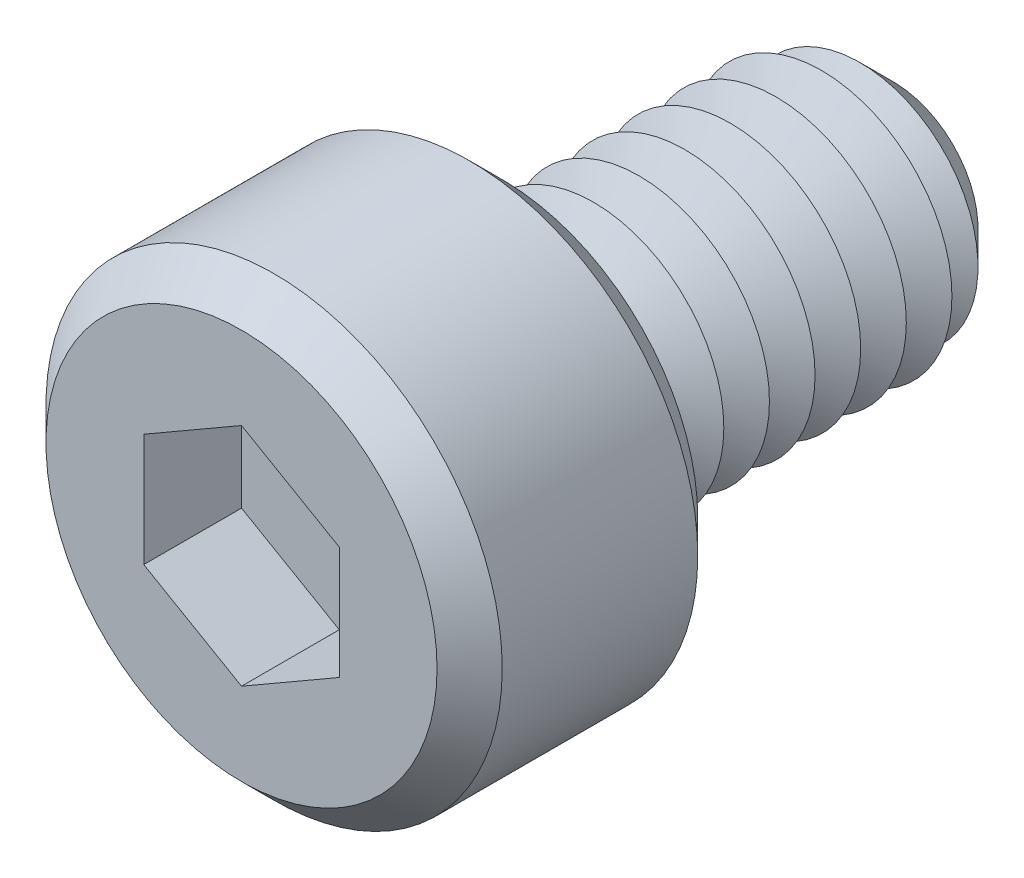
SolidWorks part; units mm, degrees
ref_plane "Front Plane" through (0, 0, 0) normal (0, 0, 1) x (1, 0, 0)
ref_plane "Top Plane" through (0, 0, 0) normal (0, 1, 0) x (1, 0, 0)
ref_plane "Right Plane" through (0, 0, 0) normal (1, 0, 0) x (0, 0, -1)
sketch "Sketch1" plane through (0, 0, 0) normal (0, 0, 1) x (1, 0, 0)
  circle A0 centre (0, 0) radius 3.5
  dimension "D1" = 7
extrude "Boss-Extrude1" add sketch "Sketch1" along normal blind 4
sketch "Sketch2" plane through (0, 0, 0) normal (0, 0, -1) x (-1, 0, 0)
  circle A0 centre (0, 0) radius 2
  dimension "D1" = 4
extrude "Boss-Extrude2" add sketch "Sketch2" along normal blind 6
chamfer "Chamfer1" distance 0.7 angle 45 1 edges at (-2, 0, -6)
sketch "Sketch3" plane through (0, 0, 0) normal (1, 0, 0) x (0, 0, -1)
  line L0 (-2.5121, 0) -> (4.5776, 0) construction
sketch "Sketch4" plane through (0, 0, 0) normal (1, 0, 0) x (0, 0, -1)
  line L0 (0, 2) -> (0.35, 1.3938)
  line L1 (0.35, 1.3938) -> (0.7, 2)
  line L2 (5.3, 2) -> (0, 2) construction
  line L3 (0.7, 2) -> (0, 2)
  dimension "D1" = 0.7
revolve "Cut-Revolve1" cut sketch "Sketch4" angle 360 about L0
pattern_linear "LPattern1" count 8 spacing 0.7 along (0, 0, -1) of "Cut-Revolve1"
sketch "Sketch5" plane through (0, 0, 4) normal (0, 0, 1) x (1, 0, 0)
  line L1 (0, 1.7321) -> (-1.5, 0.866)
  line L2 (-1.5, 0.866) -> (-1.5, -0.866)
  line L3 (-1.5, -0.866) -> (0, -1.7321)
  line L4 (0, -1.7321) -> (1.5, -0.866)
  line L5 (1.5, -0.866) -> (1.5, 0.866)
  line L6 (1.5, 0.866) -> (0, 1.7321)
  circle A0 centre (0, 0) radius 1.5 construction
  dimension "D1" = 3
extrude "Cut-Extrude1" cut sketch "Sketch5" against normal blind 1.5
sketch "Sketch6" plane through (0, 0, 2.5) normal (0, 0, 1) x (1, 0, 0)
  circle A0 centre (0, 0) radius 0.5
  dimension "D1" = 1
extrude "Cut-Extrude2" cut sketch "Sketch6" against normal up to surface (8.5 mm away)
chamfer "Chamfer2" distance 0.5 angle 45 2 edges at (3.5, 0, 0) (3.5, 0, 4)
